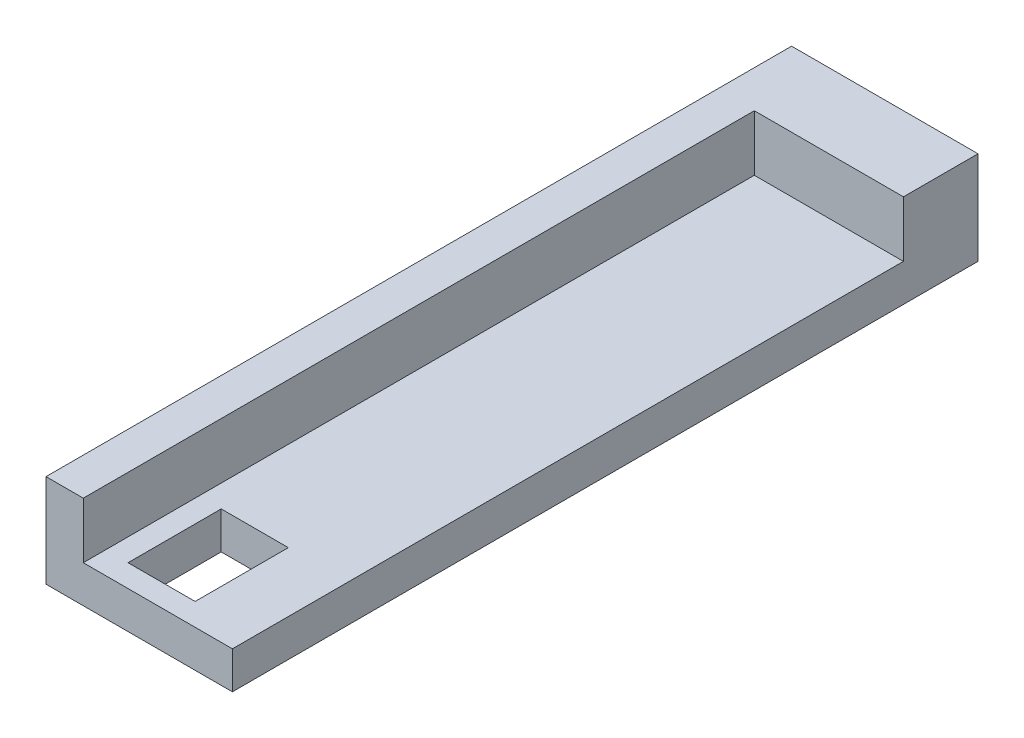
SolidWorks part; units mm, degrees
ref_plane "Front Plane" through (0, 0, 0) normal (0, 0, 1) x (1, 0, 0)
ref_plane "Top Plane" through (0, 0, 0) normal (0, 1, 0) x (1, 0, 0)
ref_plane "Right Plane" through (0, 0, 0) normal (1, 0, 0) x (0, 0, -1)
sketch "Sketch1" plane through (0, 0, 0) normal (0, 0, 1) x (1, 0, 0)
  line L1 (0, 0) -> (50, 0)
  line L2 (0, 0) -> (0, 25)
  line L3 (0, 25) -> (50, 25)
  line L4 (50, 0) -> (50, 25)
  dimension "D1" = 50
  dimension "D2" = 25
extrude "Boss-Extrude1" add sketch "Sketch1" along normal blind 200
shell "Shell1" thickness 10
sketch "Sketch2" plane through (0, 10, 0) normal (0, 1, 0) x (1, 0, 0)
  line L0 (10, -200) -> (10, -20) construction
  line L1 (16, -194) -> (34, -194)
  line L2 (16, -194) -> (16, -169)
  line L5 (16, -169) -> (34, -169)
  line L6 (34, -194) -> (34, -169)
  line L7 (10, -200) -> (50, -200) construction
  dimension "D4" = 25
  dimension "D1" = 6
  dimension "D2" = 6
  dimension "D3" = 18
extrude "Cut-Extrude1" cut sketch "Sketch2" against normal through all
